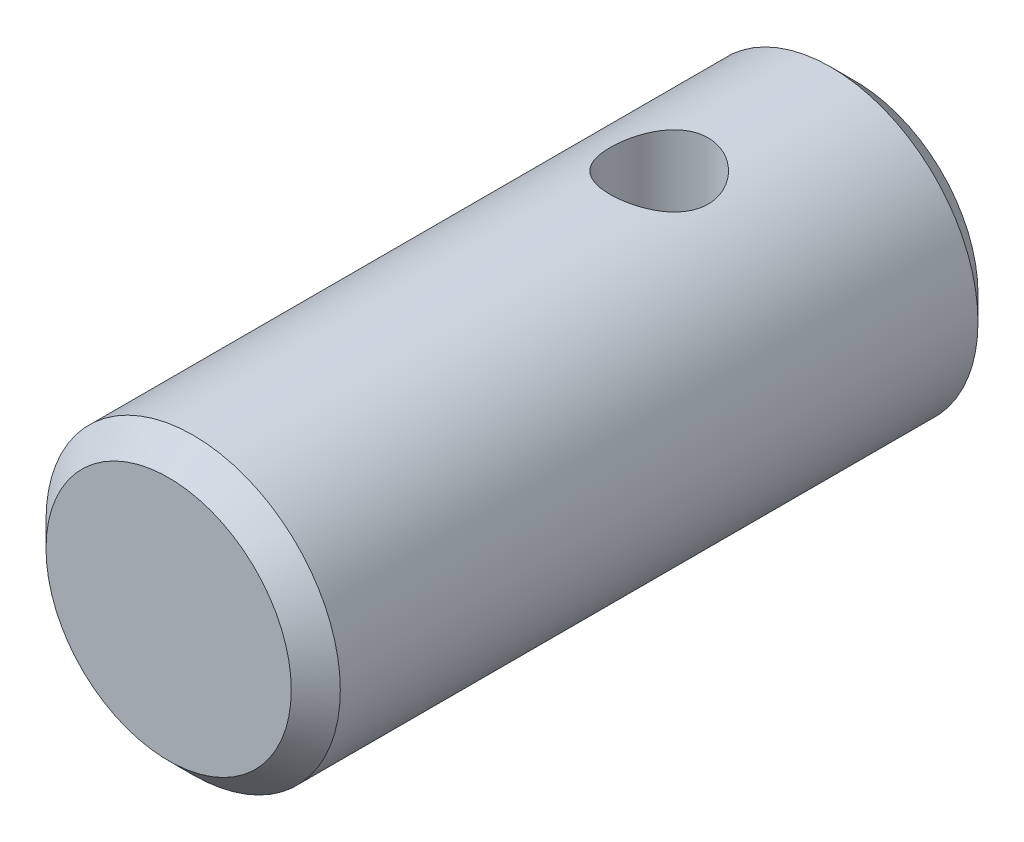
SolidWorks part; units mm, degrees
ref_plane "Frontal" through (0, 0, 0) normal (0, 0, 1) x (1, 0, 0)
ref_plane "Horizontal" through (0, 0, 0) normal (0, 1, 0) x (1, 0, 0)
ref_plane "Vertical" through (0, 0, 0) normal (1, 0, 0) x (0, 0, -1)
sketch "Esquisse1" plane through (0, 0, 0) normal (0, 0, 1) x (1, 0, 0)
  circle A0 centre (0, 0) radius 3
  dimension "D1" = 6
extrude "Extrusion1" add sketch "Esquisse1" along normal mid plane 14
chamfer "Chanfrein1" distance 0.5 angle 45 2 edges at (3, 0, -7) (3, 0, 7)
sketch "Esquisse2" plane through (0, 0, 0) normal (0, 1, 0) x (1, 0, 0)
  line L0 (0, 22.2486) -> (0, -22.7922) construction
  line L2 (2.5, 7) -> (-2.5, 7) construction
  circle A0 centre (0, 3) radius 1
  circle A1 centre (0, -24) radius 0.8
  dimension "D1" = 2
  dimension "D2" = 4
extrude "Extrusion2" cut sketch "Esquisse2" against normal through all and the other way through all
